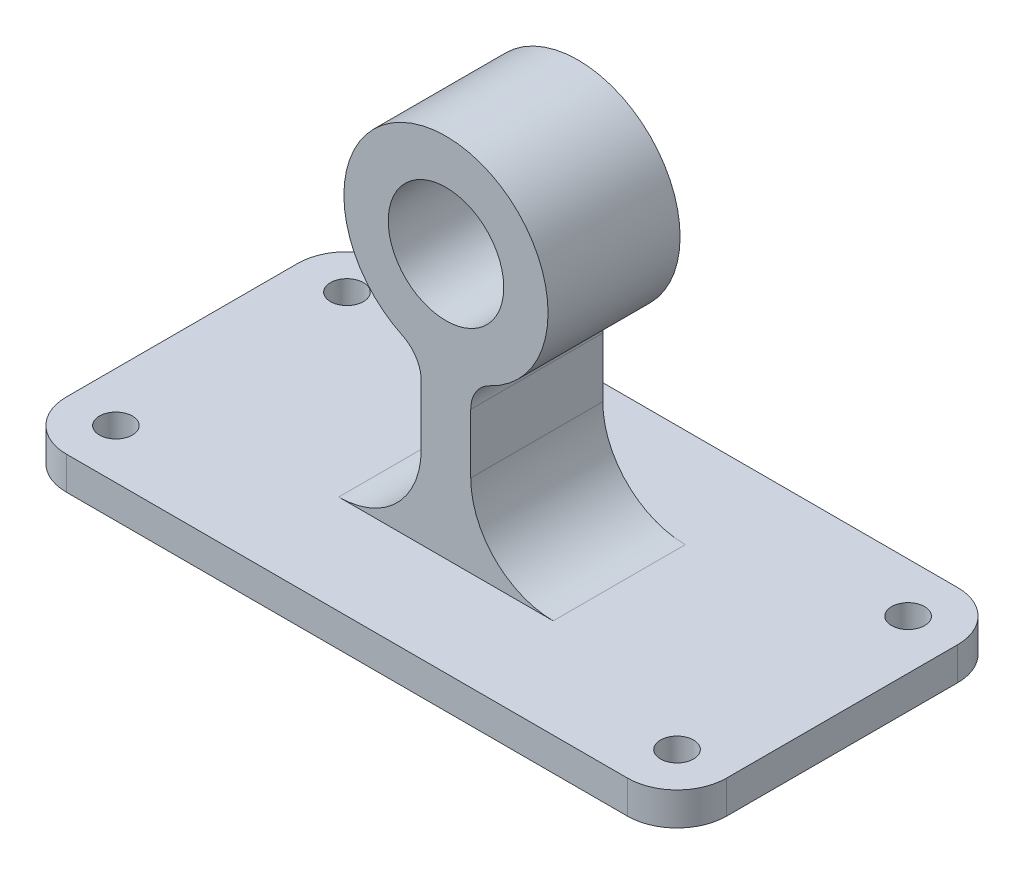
SolidWorks part; units mm, degrees
ref_plane "Front Plane" through (0, 0, 0) normal (0, 0, 1) x (1, 0, 0)
ref_plane "Top Plane" through (0, 0, 0) normal (0, 1, 0) x (1, 0, 0)
ref_plane "Right Plane" through (0, 0, 0) normal (1, 0, 0) x (0, 0, -1)
sketch "Sketch2" plane through (0, 0, 0) normal (0, 1, 0) x (1, 0, 0)
  line L1 (15, 0) -> (185, 0)
  line L2 (0, 15) -> (0, 85)
  line L3 (15, 100) -> (185, 100)
  line L4 (200, 15) -> (200, 85)
  arc A0 (15, 0) -> (0, 15) centre (15, 15) cw
  arc A1 (185, 0) -> (200, 15) centre (185, 15) ccw
  arc A2 (0, 85) -> (15, 100) centre (15, 85) cw
  arc A3 (200, 85) -> (185, 100) centre (185, 85) ccw
  circle A4 centre (15, 85) radius 5
  circle A5 centre (15, 15) radius 5
  circle A6 centre (185, 15) radius 5
  circle A7 centre (185, 85) radius 5
  point P8 (0, 0)
  point P13 (0, 100)
  point P16 (200, 100)
extrude "Boss-Extrude1" add sketch "Sketch2" along normal blind 10
sketch "Sketch3" plane through (0, 10, 0) normal (0, 1, 0) x (1, 0, 0)
  line L0 (100, 50) -> (0, 50) construction
  line L3 (0, 85) -> (0, 15) construction
  line L4 (92.5, 30) -> (107.5, 30)
  line L5 (92.5, 30) -> (92.5, 70)
  line L6 (92.5, 70) -> (107.5, 70)
  line L7 (107.5, 30) -> (107.5, 70)
  line L8 (92.5, 30) -> (107.5, 70) construction
  line L9 (92.5, 70) -> (107.5, 30) construction
  line L10 (100, 50) -> (100, 100) construction
  line L11 (185, 100) -> (15, 100) construction
  point P4 (0, 0)
  point P6 (100, 50)
  dimension "D1" = 100
  dimension "D2" = 100
  dimension "D3" = 40
  dimension "D4" = 15
extrude "Boss-Extrude2" add sketch "Sketch3" along normal blind 50
fillet "Fillet1" radius 25 2 edges at (92.5, 10, -50) (107.5, 10, -50)
sketch "Sketch4" plane through (0, 0, -30) normal (0, 0, 1) x (1, 0, 0)
  line L0 (100, 60) -> (100, 90)
  line L1 (92.5, 60) -> (107.5, 60) construction
  circle A0 centre (100, 90) radius 30.9233
extrude "Boss-Extrude3" add sketch "Sketch4" against normal blind 40 contours A0
fillet "Fillet2" radius 10 2 edges at (107.5, 60, -50) (92.5, 60, -50)
sketch "Sketch5" plane through (0, 0, -30) normal (0, 0, 1) x (1, 0, 0)
  circle A0 centre (100, 90) radius 17.5
extrude "Cut-Extrude1" cut sketch "Sketch5" against normal blind 40
equation "\"base\"=200"
equation "\"ft\"=15"
equation "\"shaft diameter\"= 35mm"
equation "\"D1@Sketch5\"=\"shaft diameter\""
equation "\"D2@Sketch2\"=\"base\""
equation "\"D1@Sketch2\"=\"base\"/2"
equation "\"D4@Sketch2\"=\"ft\"/1.5"
